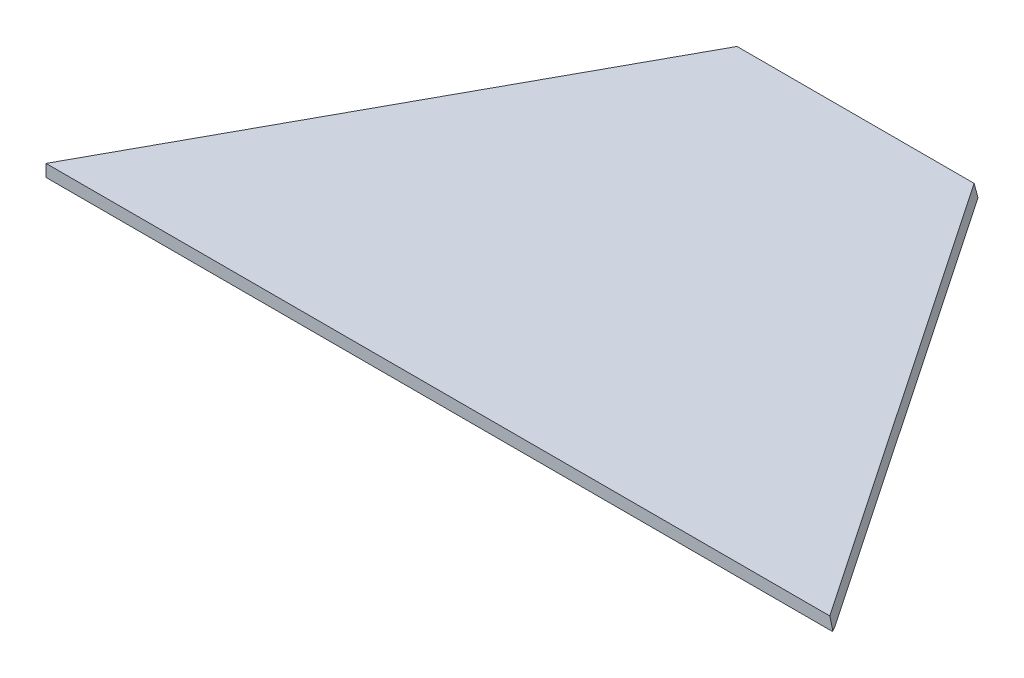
SolidWorks part; units mm, degrees
ref_plane "Vorderansicht" through (0, 0, 0) normal (0, 0, 1) x (1, 0, 0)
ref_plane "Draufsicht" through (0, 0, 0) normal (0, 1, 0) x (1, 0, 0)
ref_plane "Seitenansicht" through (0, 0, 0) normal (1, 0, 0) x (0, 0, -1)
sketch "Skizze1" plane through (0, 0, 0) normal (0, 1, 0) x (-1, 0, 0)
  line L0 (0, 0) -> (0, -192.1512) construction
  line L1 (22.1191, -136.9979) -> (97, 0)
  line L2 (-22.1191, -136.9979) -> (-97, 0)
  line L3 (-97, 0) -> (97, 0)
  line L8 (-22.1191, -136.9979) -> (22.1191, -136.9979)
  dimension "D2" = 44.2381
  dimension "D3" = 194
extrude "Linear austragen1" add sketch "Skizze1" along normal blind 3
other "Formnest3"
other "Boden_lang<5>@Behaelter2"
other "Ausfluss<1>@Behaelter2"
sketch "Skizze2" plane through (63.3375, 17.4131, -42.8693) normal (0.8075, 0.222, -0.5465) x (-0.527, -0.1449, -0.8374)
  line L1 (-54.4127, 5.7008) -> (98.4421, 5.7008)
  line L2 (-54.4127, 5.7008) -> (-54.4127, -68.7992)
  line L3 (-54.4127, -68.7992) -> (109.6451, -68.7992)
  line L4 (98.4421, 5.7008) -> (109.6451, -68.7992)
extrude "Linear austragen2" cut sketch "Skizze2" along normal blind 68
sketch "Skizze4" plane through (0, 13.8969, -108.8097) normal (0, 0.1267, -0.9919) x (-1, 0, 0)
  line L1 (-142.6717, 38.7214) -> (121.1583, 38.7214)
  line L2 (-142.6717, 38.7214) -> (-142.6717, -144.5841)
  line L3 (-142.6717, -144.5841) -> (121.1583, -144.5841)
  line L4 (121.1583, 38.7214) -> (121.1583, -144.5841)
extrude "Linear austragen4" cut sketch "Skizze4" along normal blind 68
